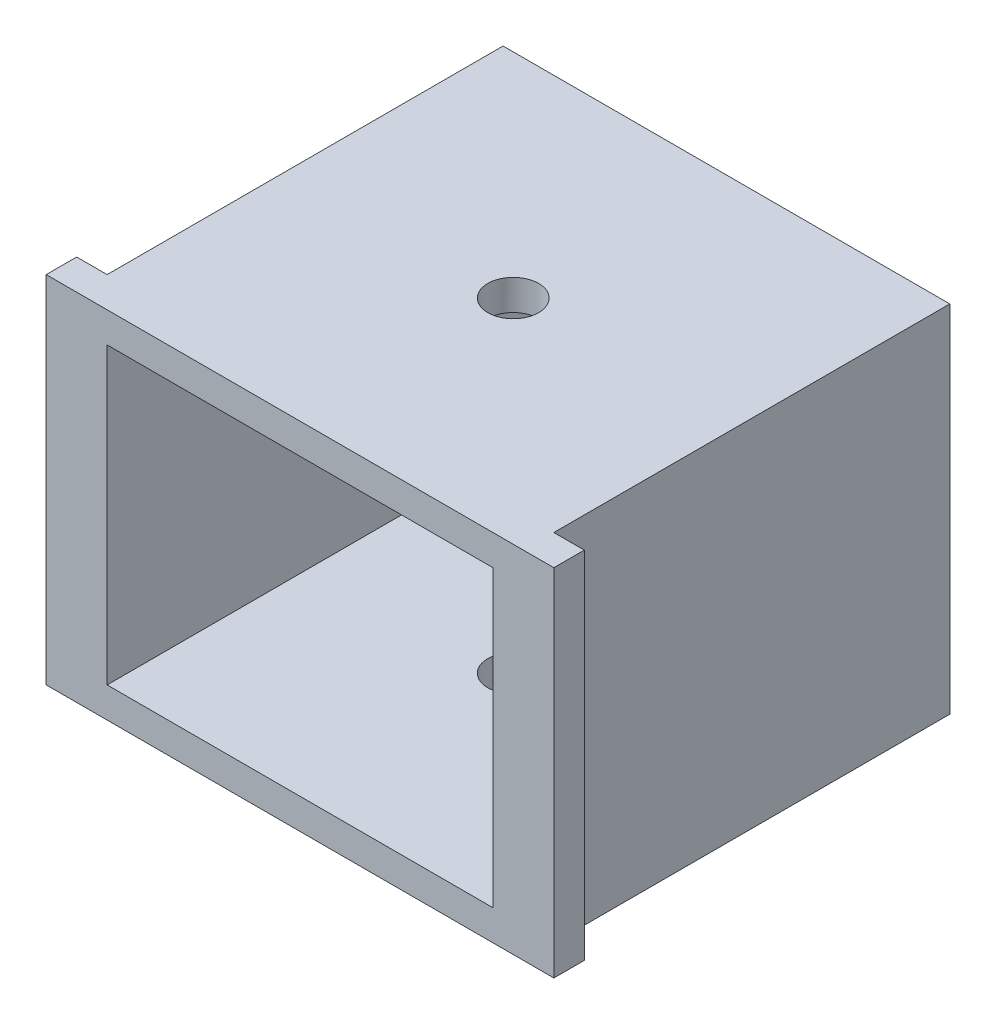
SolidWorks part; units mm, degrees
ref_plane "Alzado" through (0, 0, 0) normal (0, 0, 1) x (1, 0, 0)
ref_plane "Planta" through (0, 0, 0) normal (0, 1, 0) x (1, 0, 0)
ref_plane "Vista lateral" through (0, 0, 0) normal (1, 0, 0) x (0, 0, -1)
ref_plane "Plano1" through (0, 0, 0) normal (0, -1, 0) x (1, 0, 0)
sketch "Croquis1" plane through (0, 0, 0) normal (0, -1, 0) x (1, 0, 0)
  line L0 (0, 42) -> (0, 0)
  line L1 (0, 0) -> (50, 0)
  line L2 (50, 0) -> (50, 42)
  line L3 (50, 42) -> (0, 42)
  point P4 (0, 0)
  dimension "D1" = 50
  dimension "D2" = 42
extrude "Saliente-Extruir1" add sketch "Croquis1" against normal blind 35
sketch "Croquis2" plane through (0, 35, 0) normal (0, 1, 0) x (-1, 0, 0)
  line L0 (-47, 0) -> (-47, 39)
  line L1 (-47, 39) -> (-50, 39)
  line L2 (-50, 39) -> (-50, 0)
  line L3 (-50, 0) -> (-47, 0)
  line L4 (-50, 42) -> (0, 42) construction
  point P4 (0, 0)
  dimension "D1" = 3
  dimension "D2" = 3
extrude "Cortar-Extruir1" cut sketch "Croquis2" against normal through all
sketch "Croquis3" plane through (0, 35, 0) normal (0, 1, 0) x (-1, 0, 0)
  line L0 (-3, 0) -> (-3, 39)
  line L1 (-3, 39) -> (0, 39)
  line L2 (0, 39) -> (0, 0)
  line L3 (0, 0) -> (-3, 0)
  line L4 (-50, 42) -> (0, 42) construction
  point P6 (0, 0)
  dimension "D1" = 3
  dimension "D2" = 3
extrude "Cortar-Extruir2" cut sketch "Croquis3" against normal through all
sketch "Croquis4" plane through (0, 0, 0) normal (0, 0, -1) x (-1, 0, 0)
  line L0 (-6, 3) -> (-6, 32)
  line L1 (-6, 32) -> (-44, 32)
  line L2 (-44, 32) -> (-44, 3)
  line L3 (-44, 3) -> (-6, 3)
  line L4 (-47, 0) -> (-47, 35) construction
  line L5 (-3, 0) -> (-3, 35) construction
  line L6 (-3, 35) -> (-47, 35) construction
  line L7 (-3, 0) -> (-47, 0) construction
  dimension "D1" = 3
  dimension "D2" = 3
  dimension "D3" = 3
  dimension "D4" = 3
extrude "Cortar-Extruir3" cut sketch "Croquis4" against normal through all
hole_wizard "Diámetro de taladro Ø5.0 (5)1" positions "Croquis6" profile "Croquis5" hole size "Ø5.0" standard "Ansi Metric"
sketch "Croquis6" plane through (0, 35, 0) normal (0, 1, 0) x (1, 0, 0)
  line L0 (50, -42) -> (0, -42) construction
  point P0 (25, -21)
  point P8 (20.3922, -33.0974)
  dimension "D1" = 21
  dimension "D2" = 25
sketch "Croquis5" plane through (25, 35, 21) normal (1, 0, 0) x (0, 0, 1)
  line L0 (0, 0) -> (0, 3)
  line L1 (0, 3) -> (2.5, 3)
  line L2 (2.5, 3) -> (2.5, 0)
  line L5 (2.5, 0) -> (0, 0)
  line L11 (0, -6.35) -> (0, 107.95) construction
  dimension "Diámetro de taladro hasta el siguiente" = 5
  dimension "Profundidad de taladro hasta el siguiente" = 3
hole_wizard "Diámetro de taladro Ø5.0 (5)2" positions "Croquis8" profile "Croquis7" hole size "Ø5.0" standard "Ansi Metric"
sketch "Croquis8" plane through (0, 0, 0) normal (0, -1, 0) x (-1, 0, 0)
  line L0 (-50, -42) -> (0, -42) construction
  point P0 (-25, -21)
  dimension "D1" = 25
  dimension "D2" = 21
sketch "Croquis7" plane through (25, 0, 21) normal (1, 0, 0) x (0, 0, -1)
  line L0 (0, 0) -> (0, 35)
  line L1 (0, 35) -> (2.5, 35)
  line L2 (2.5, 35) -> (2.5, 0)
  line L5 (2.5, 0) -> (0, 0)
  line L11 (0, -6.35) -> (0, 107.95) construction
  dimension "Diámetro de taladro hasta el siguiente" = 5
  dimension "Profundidad de taladro hasta el siguiente" = 35
